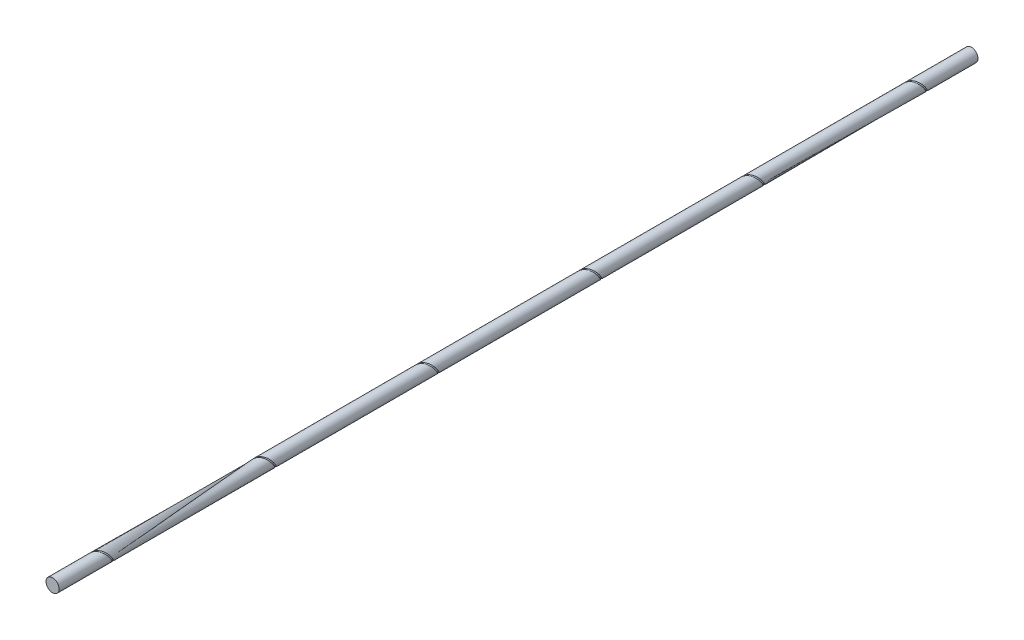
SolidWorks part; units mm, degrees
ref_plane "Front Plane" through (0, 0, 0) normal (0, 0, 1) x (1, 0, 0)
ref_plane "Top Plane" through (0, 0, 0) normal (0, 1, 0) x (1, 0, 0)
ref_plane "Right Plane" through (0, 0, 0) normal (1, 0, 0) x (0, 0, -1)
sketch "Sketch1" plane through (0, 0, 0) normal (0, 0, 1) x (1, 0, 0)
  circle A0 centre (0, 0) radius 25
  dimension "D1" = 50
extrude "Boss-Extrude1" add sketch "Sketch1" along normal blind 3500
ref_plane "Plane1" through (0, 0, 150) normal (0, 0, 1) x (1, 0, 0)
sketch "Sketch2" plane through (0, 0, 150) normal (0, 0, 1) x (1, 0, 0)
  circle A0 centre (0, 0) radius 27.646
  dimension "D1" = 55.292
curve "Helix/Spiral1"
sketch "Sketch3" plane through (0, 0, 0) normal (0, 1, 0) x (1, 0, 0)
  circle A0 centre (-27.646, -150) radius 3.969
  spline S0 degree 3 poles (-27.646, -150) (-27.646, -151.3307) (-27.0608, -154.0012) (-24.4828, -157.9997) (-20.3663, -162.0001) (-14.9702, -166) (-8.6335, -170) (-1.7543, -174) (5.2352, -178) (11.8957, -182) (17.8087, -186) (22.6028, -190) (25.9766, -194) (27.7183, -198) (27.7183, -202) (25.9766, -206) (22.6028, -210) (17.8087, -214) (11.8957, -218) (5.2352, -222) (-1.7543, -226) (-8.6335, -230) (-14.9702, -234) (-20.3663, -237.9999) (-24.4828, -242.0003) (-27.0608, -245.9988) (-27.646, -248.6693) (-27.646, -250) knots 0 0 0 0 0.04 0.08 0.12 0.16 0.2 0.24 0.28 0.32 0.36 0.4 0.44 0.48 0.52 0.56 0.6 0.64 0.68 0.72 0.76 0.8 0.84 0.88 0.92 0.96 1 1 1 1 construction
  dimension "D1" = 7.938
sweep "Cut-Sweep1" cut profiles "Sketch3" path "Helix/Spiral1"
pattern_linear "LPattern1" count 6 spacing 620 along (0, 0, -1) of "Cut-Sweep1"
